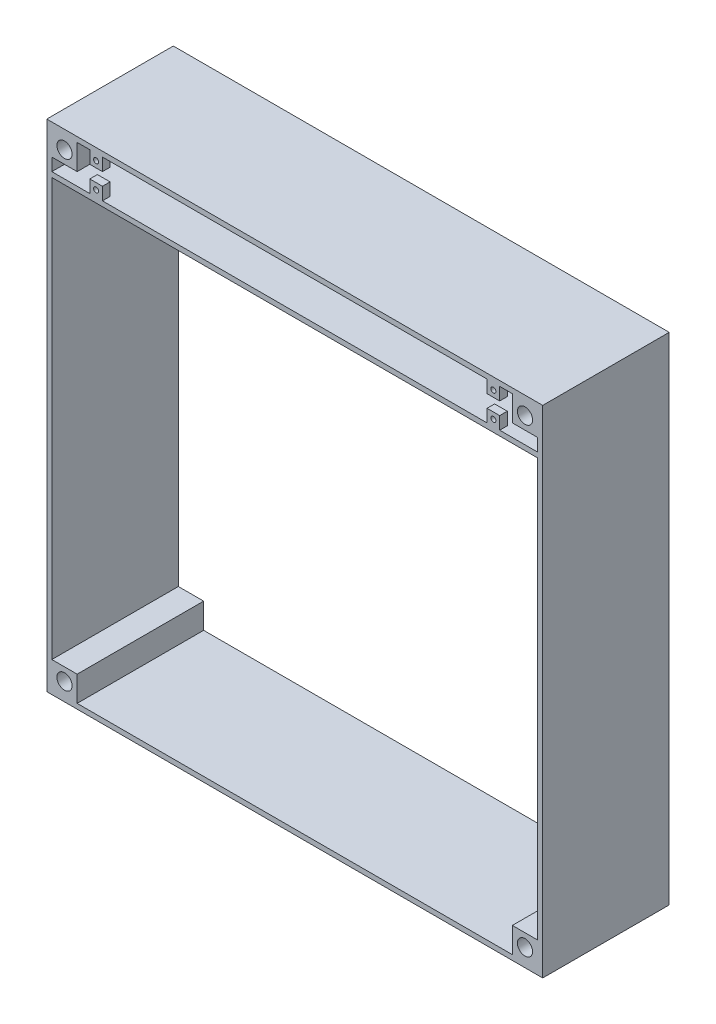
SolidWorks part; units mm, degrees
ref_plane "Front Plane" through (0, 0, 0) normal (0, 0, 1) x (1, 0, 0)
ref_plane "Top Plane" through (0, 0, 0) normal (0, 1, 0) x (1, 0, 0)
ref_plane "Right Plane" through (0, 0, 0) normal (1, 0, 0) x (0, 0, -1)
sketch "Sketch1" plane through (0, 0, 0) normal (0, 0, 1) x (1, 0, 0)
  line L0 (0, 248.92) -> (248.92, 248.92)
  line L1 (-2.54, -2.54) -> (251.46, -2.54)
  line L2 (-2.54, -2.54) -> (-2.54, 251.46)
  line L3 (-2.54, 251.46) -> (251.46, 251.46)
  line L4 (251.46, -2.54) -> (251.46, 251.46)
  line L5 (248.92, 0) -> (248.92, 248.92)
  line L6 (0, 0) -> (248.92, 0)
  line L7 (0, 0) -> (0, 248.92)
  line L8 (2.54, 246.38) -> (246.38, 246.38)
  line L9 (246.38, 2.54) -> (246.38, 246.38)
  line L10 (2.54, 2.54) -> (246.38, 2.54)
  line L11 (2.54, 2.54) -> (2.54, 246.38)
  dimension "D1" = 254
  dimension "D2" = 254
  dimension "D3" = 2.54
  dimension "D4" = 2.54
extrude "Boss-Extrude1" add sketch "Sketch1" along normal mid plane 63.5 contours L7 L6 L5 L0 L10 L11 L8 L9
sketch "Sketch2" plane through (0, 0, 0) normal (0, 0, 1) x (1, 0, 0)
  line L0 (246.38, 2.54) -> (246.38, 246.38) construction
  line L1 (2.54, 246.38) -> (246.38, 246.38)
  line L2 (2.54, 246.38) -> (2.54, 227.33)
  line L3 (2.54, 227.33) -> (246.38, 227.33)
  line L4 (246.38, 246.38) -> (246.38, 227.33)
  line L6 (2.54, 227.33) -> (246.38, 227.33)
  line L7 (2.54, 227.33) -> (2.54, 224.79)
  line L8 (2.54, 224.79) -> (246.38, 224.79)
  line L9 (246.38, 227.33) -> (246.38, 224.79)
  dimension "D1" = 19.05
  dimension "D2" = 2.54
extrude "Extrude-Thin1" add sketch "Sketch2" along normal mid plane 63.5 thin contours L7 L8 L9
sketch "Sketch4" plane through (0, 224.79, 0) normal (0, -1, 0) x (1, 0, 0)
  line L0 (0, 0) -> (248.92, 0) construction
  line L1 (248.92, 31.75) -> (248.92, -31.75) construction
  line L2 (2.54, 31.75) -> (2.54, -31.75) construction
  line L3 (246.38, 31.75) -> (246.38, -31.75) construction
  circle A0 centre (33.02, 0) radius 6.35
  circle A1 centre (215.9, 0) radius 6.35
  circle A2 centre (93.98, 0) radius 8.8635
  circle A3 centre (154.94, 0) radius 8.2202
  dimension "D3" = 12.7
  dimension "D4" = 12.7
  dimension "D1" = 30.48
  dimension "D2" = 30.48
  dimension "D5" = 60.96
  dimension "D6" = 60.96
extrude "Cut-Extrude1" cut sketch "Sketch4" against normal blind 2.54 contours L0 A2 | A2 L0 | A3 L0 | L0 A3 | A0 | A1
sketch "Sketch5" plane through (0, 0, 31.75) normal (0, 0, 1) x (1, 0, 0)
  line L0 (21.59, 227.33) -> (21.59, 233.68)
  line L1 (246.38, 227.33) -> (2.54, 227.33) construction
  line L2 (21.59, 233.68) -> (27.94, 233.68)
  line L3 (27.94, 233.68) -> (27.94, 227.33)
  line L4 (124.46, 246.38) -> (124.46, 185.7467) construction
  line L5 (2.54, 246.38) -> (246.38, 246.38) construction
  line L6 (220.98, 233.68) -> (220.98, 227.33)
  line L7 (227.33, 233.68) -> (220.98, 233.68)
  line L8 (227.33, 227.33) -> (227.33, 233.68)
  line L9 (2.54, 236.855) -> (142.3624, 236.855) construction
  line L10 (2.54, 227.33) -> (2.54, 246.38) construction
  line L11 (227.33, 246.38) -> (227.33, 240.03)
  line L12 (227.33, 240.03) -> (220.98, 240.03)
  line L13 (220.98, 240.03) -> (220.98, 246.38)
  line L14 (27.94, 240.03) -> (27.94, 246.38)
  line L15 (21.59, 240.03) -> (27.94, 240.03)
  line L16 (21.59, 246.38) -> (21.59, 240.03)
  circle A0 centre (24.765, 230.505) radius 1.27
  circle A1 centre (224.155, 230.505) radius 1.27
  circle A2 centre (224.155, 243.205) radius 1.27
  circle A3 centre (24.765, 243.205) radius 1.27
  point P18 (24.765, 233.68)
  point P20 (21.59, 230.505)
  dimension "D4" = 2.54
  dimension "D1" = 6.35
  dimension "D2" = 6.35
  dimension "D3" = 19.05
extrude "Boss-Extrude2" add sketch "Sketch5" against normal blind 3.81 contours L8 L7 L6 M3 | L3 L2 L0 M3 | L13 L12 L11 A2 M5 | L16 L15 L14 A3 M5
mirror "Mirror1" about plane through (0, 0, 0) normal (0, 0, 1) of "Boss-Extrude2"
sketch "Sketch6" plane through (0, 0, 0) normal (0, 0, 1) x (1, 0, 0)
  line L0 (124.46, 2.54) -> (124.46, 104.3744) construction
  line L1 (2.54, 2.54) -> (15.24, 2.54)
  line L2 (2.54, 2.54) -> (2.54, 15.24)
  line L3 (2.54, 15.24) -> (15.24, 15.24)
  line L4 (15.24, 2.54) -> (15.24, 15.24)
  line L5 (2.54, 2.54) -> (246.38, 2.54) construction
  line L6 (233.68, 2.54) -> (233.68, 15.24)
  line L7 (246.38, 15.24) -> (233.68, 15.24)
  line L8 (246.38, 2.54) -> (246.38, 15.24)
  line L9 (246.38, 2.54) -> (233.68, 2.54)
  line L10 (248.92, 124.46) -> (118.39, 124.46) construction
  line L11 (248.92, 0) -> (248.92, 248.92) construction
  line L12 (246.38, 246.38) -> (233.68, 246.38)
  line L13 (246.38, 246.38) -> (246.38, 233.68)
  line L14 (246.38, 233.68) -> (233.68, 233.68)
  line L15 (233.68, 246.38) -> (233.68, 233.68)
  line L16 (15.24, 246.38) -> (15.24, 233.68)
  line L17 (2.54, 233.68) -> (15.24, 233.68)
  line L18 (2.54, 246.38) -> (2.54, 233.68)
  line L19 (2.54, 246.38) -> (15.24, 246.38)
  circle A0 centre (8.89, 8.89) radius 3.81
  circle A1 centre (240.03, 8.89) radius 3.81
  circle A2 centre (240.03, 240.03) radius 3.81
  circle A3 centre (8.89, 240.03) radius 3.81
  point P8 (8.89, 15.24)
  point P10 (15.24, 8.89)
  dimension "D1" = 7.62
  dimension "D2" = 12.7
  dimension "D3" = 12.7
extrude "Boss-Extrude3" add sketch "Sketch6" along normal mid plane 63.5 contours L12 L15 L14 L13 A2 | L1 L4 L3 L2 A0 | L9 L8 L7 L6 A1 | L19 L18 L17 L16 A3
